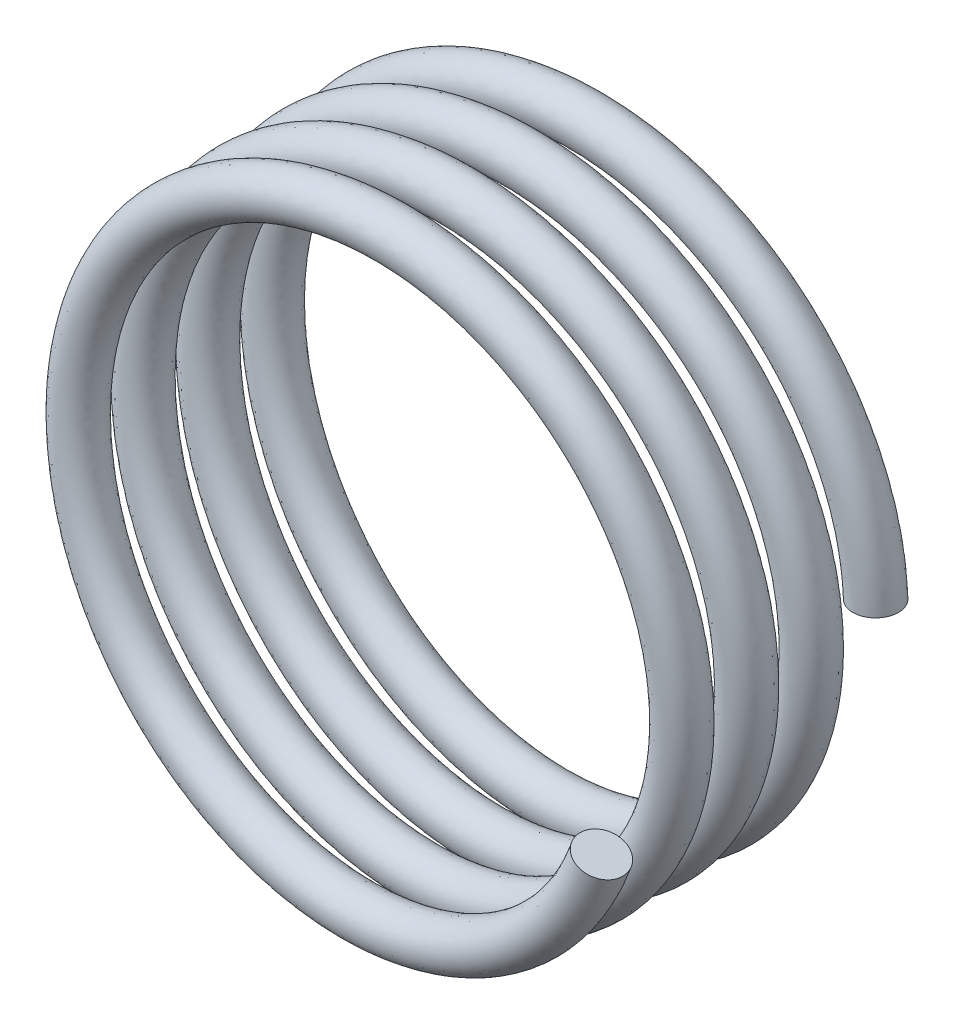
SolidWorks part; units mm, degrees
ref_plane "Alzado" through (0, 0, 0) normal (0, 0, 1) x (1, 0, 0)
ref_plane "Planta" through (0, 0, 0) normal (0, 1, 0) x (1, 0, 0)
ref_plane "Vista lateral" through (0, 0, 0) normal (1, 0, 0) x (0, 0, -1)
ref_plane "Plano1" through (0, 0, 115.1039) normal (0, 0, 1) x (1, 0, 0)
sketch "Sk_Helice_Muelle_B" plane through (0, 0, 115.1039) normal (0, 0, 1) x (1, 0, 0)
  circle A0 centre (-6, -26) radius 7.5
curve "Helice_Muelle_B"
ref_plane "Plano3" through (0, -26, 0) normal (0, 1, 0) x (1, 0, 0)
sketch "Sk_alambre" plane through (0, -26, 0) normal (0, 1, 0) x (1, 0, 0)
  circle A0 centre (1.5, -55) radius 0.6
sweep "Muelle_B" add profiles "Sk_alambre" path "Helice_Muelle_B"
